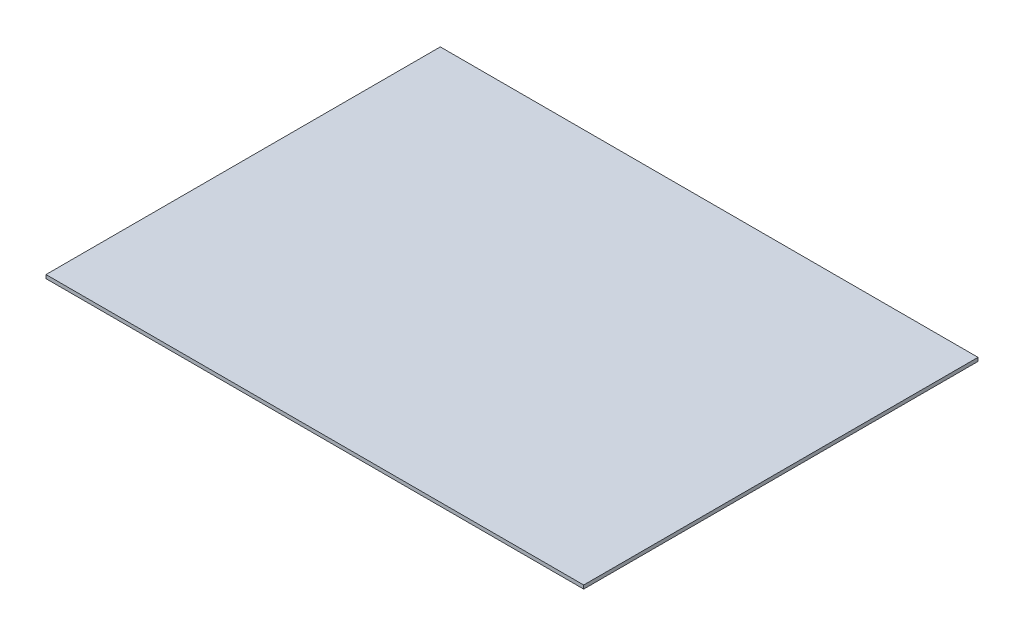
SolidWorks part; units mm, degrees
ref_plane "Front" through (0, 0, 0) normal (0, 0, 1) x (1, 0, 0)
ref_plane "Top" through (0, 0, 0) normal (0, 1, 0) x (1, 0, 0)
ref_plane "Right" through (0, 0, 0) normal (1, 0, 0) x (0, 0, -1)
sketch "Sketch1" plane through (0, 0, 0) normal (0, 1, 0) x (1, 0, 0)
  line L1 (0, 0) -> (114.3, 0)
  line L2 (0, 0) -> (0, 83.82)
  line L3 (0, 83.82) -> (114.3, 83.82)
  line L4 (114.3, 0) -> (114.3, 83.82)
  dimension "D1" = 83.82
  dimension "D2" = 114.3
extrude "Boss-Extrude1" add sketch "Sketch1" along normal blind 0.762
other "Cosmetic Pattern2" parameters "D10"=3.175, "D1"=6.35, "D2"=45
